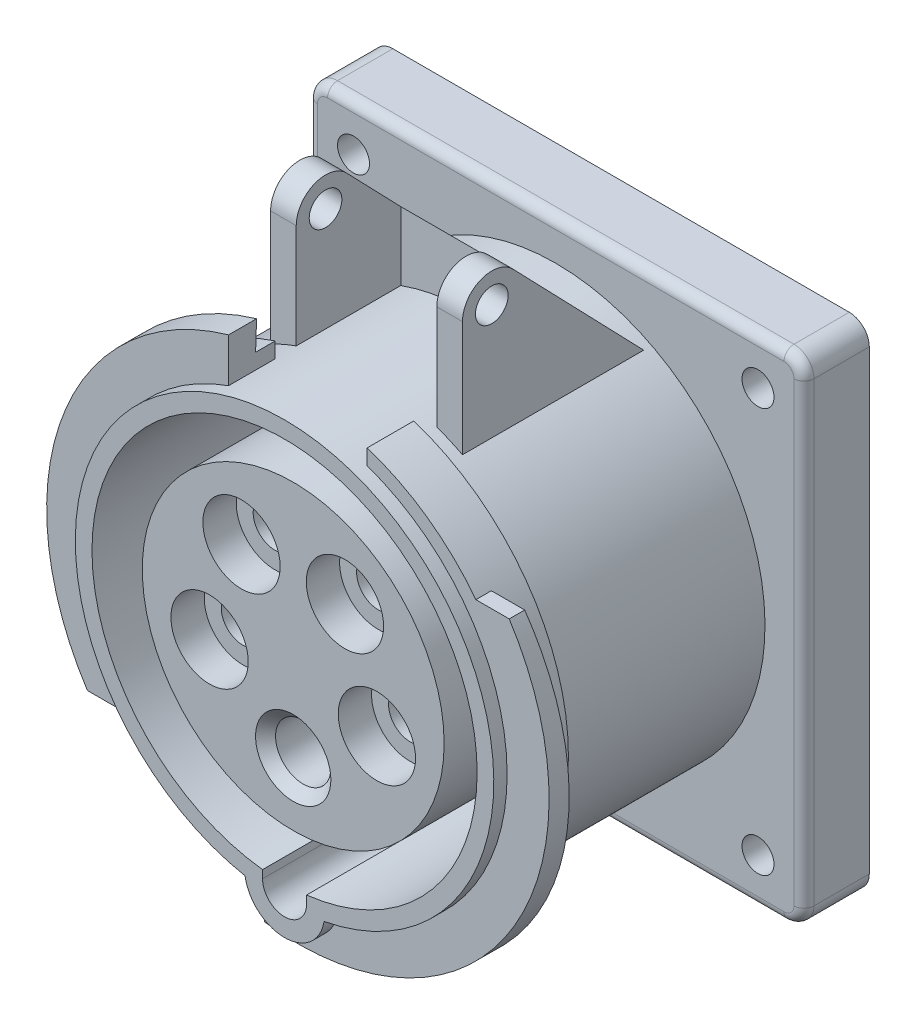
SolidWorks part; units mm, degrees
ref_plane "Спереди" through (0, 0, 0) normal (0, 0, 1) x (1, 0, 0)
ref_plane "Сверху" through (0, 0, 0) normal (0, 1, 0) x (1, 0, 0)
ref_plane "Справа" through (0, 0, 0) normal (1, 0, 0) x (0, 0, -1)
sketch "Эскиз1" plane through (0, 0, 0) normal (0, 0, 1) x (1, 0, 0)
  line L0 (-30.35, 30.35) -> (-30.35, -30.35) construction
  line L1 (-37.25, -37.25) -> (37.25, -37.25)
  line L2 (-37.25, -37.25) -> (-37.25, 37.25)
  line L3 (-37.25, 37.25) -> (37.25, 37.25)
  line L4 (37.25, -37.25) -> (37.25, 37.25)
  line L5 (-37.25, -37.25) -> (37.25, 37.25) construction
  line L6 (-37.25, 37.25) -> (37.25, -37.25) construction
  line L7 (-30.35, -30.35) -> (30.35, -30.35) construction
  line L8 (30.35, -30.35) -> (30.35, 30.35) construction
  line L9 (30.35, 30.35) -> (-30.35, 30.35) construction
  circle A0 centre (-30.35, 30.35) radius 2.4
  circle A1 centre (30.35, 30.35) radius 2.4
  circle A2 centre (30.35, -30.35) radius 2.4
  circle A3 centre (-30.35, -30.35) radius 2.4
  point P0 (0, 0)
  dimension "D3" = 4.8
  dimension "D1" = 74.5
  dimension "D2" = 74.5
  dimension "D4" = 60.7
extrude "Бобышка-Вытянуть1" add sketch "Эскиз1" along normal blind 9.8
sketch "Эскиз2" plane through (0, 0, 9.8) normal (0, 0, 1) x (1, 0, 0)
  circle A0 centre (0, 0) radius 31.4
  dimension "D1" = 62.8
extrude "Бобышка-Вытянуть2" add sketch "Эскиз2" along normal blind 40.7
sketch "Эскиз3" plane through (0, 0, 50.5) normal (0, 0, 1) x (1, 0, 0)
  circle A0 centre (0, 0) radius 28.9
  circle A1 centre (0, 0) radius 22.65
  dimension "D1" = 57.8
  dimension "D2" = 45.3
extrude "Вырез-Вытянуть1" cut sketch "Эскиз3" against normal blind 39
sketch "Эскиз4" plane through (0, 0, 50.5) normal (0, 0, 1) x (1, 0, 0)
  circle A0 centre (0, 0) radius 22.65
  dimension "D1" = 45.3
extrude "Вырез-Вытянуть2" cut sketch "Эскиз4" against normal blind 1.3
sketch "Эскиз5" plane through (0, 0, 49.2) normal (0, 0, 1) x (1, 0, 0)
  line L0 (0, 0) -> (0, -13.2) construction
  line L1 (12.5539, -4.079) -> (-12.5539, -4.079) construction
  line L2 (-7.7588, 10.679) -> (7.7588, 10.679) construction
  circle A0 centre (0, -13.2) radius 4.15
  circle A8 centre (-7.7588, 10.679) radius 5.8
  circle A9 centre (7.7588, 10.679) radius 5.8
  circle A10 centre (-12.5539, -4.079) radius 5.8
  circle A11 centre (12.5539, -4.079) radius 5.8
  point P15 (0, 0)
  dimension "D1" = 8.3
  dimension "D4" = 11.6
  dimension "D2" = 15.5175
  dimension "D3" = 13.2
  dimension "D5" = 14.758
  dimension "D7" = 7.7588
  dimension "D8" = 10.679
  dimension "D9" = 25.1079
  dimension "D10" = 12.5539
extrude "Вырез-Вытянуть3" cut sketch "Эскиз5" against normal blind 5
sketch "Эскиз6" plane through (0, 0, 44.2) normal (0, 0, 1) x (1, 0, 0)
  circle A0 centre (-7.7588, 10.679) radius 3.25
  circle A1 centre (7.7588, 10.679) radius 3.25
  circle A2 centre (-12.5539, -4.079) radius 3.25
  circle A3 centre (12.5539, -4.079) radius 3.25
  circle A4 centre (0, -13.2) radius 4.15
  dimension "D1" = 6.5
  dimension "D2" = 8.3
extrude "Вырез-Вытянуть4" cut sketch "Эскиз6" against normal blind 20
chamfer "Фаска1" distance 1.5 angle 45 1 edges at (4.15, -13.2, 49.2)
sketch "Эскиз7" plane through (0, 0, 9.8) normal (0, 0, 1) x (1, 0, 0)
  arc A0 (-5.9266, -30.8356) -> (5.9266, -30.8356) centre (0, -29.9) ccw
  circle A3 centre (0, 0) radius 31.4 construction
  circle A4 centre (0, 0) radius 31.4 construction
  arc A5 (-5.9266, -30.8356) -> (5.9266, -30.8356) centre (0, 0) ccw
  point P1 (0, 0)
  point P2 (0, -31.4)
  point P3 (0, 0)
  point P4 (0, -35.9)
  dimension "D1" = 12
  dimension "D2" = 4.5
  dimension "D3" = 11.8532
extrude "Бобышка-Вытянуть3" add sketch "Эскиз7" along normal up to surface (40.7 mm away)
sketch "Эскиз8" plane through (0, 0, 50.5) normal (0, 0, 1) x (1, 0, 0)
  line L0 (-3.3, -29.9) -> (-3.3, -28.711)
  line L1 (3.3, -29.9) -> (3.3, -28.711)
  circle A1 centre (0, 0) radius 28.9 construction
  arc A2 (-3.2596, -30.4146) -> (3.2596, -30.4146) centre (0, -29.9) ccw
  arc A3 (-3.3, -29.9) -> (3.3, -29.9) centre (0, -29.9) ccw
  arc A4 (-3.3, -28.711) -> (3.3, -28.711) centre (0, 0) ccw
  dimension "D1" = 2.7
extrude "Вырез-Вытянуть5" cut sketch "Эскиз8" against normal up to surface (39 mm away)
ref_plane "Плоскость1" through (0, 0, 48.5) normal (0, 0, 1) x (1, 0, 0)
sketch "Эскиз9" plane through (0, 0, 48.5) normal (0, 0, 1) x (1, 0, 0)
  circle A0 centre (0, 0) radius 37.7
  arc A1 (-5.9266, -30.8356) -> (5.9266, -30.8356) centre (0, -29.9) ccw construction
  arc A2 (5.9266, -30.8356) -> (-5.9266, -30.8356) centre (0, 0) ccw construction
  arc A3 (-5.9266, -30.8356) -> (5.9266, -30.8356) centre (0, -29.9) ccw
  arc A4 (5.9266, -30.8356) -> (-5.9266, -30.8356) centre (0, 0) ccw
  dimension "D1" = 75.4
extrude "Бобышка-Вытянуть4" add sketch "Эскиз9" against normal blind 4.3
sketch "Эскиз10" plane through (0, 0, 44.2) normal (0, 0, -1) x (-1, 0, 0)
  line L0 (-3.3, -29.9) -> (-3.3, -28.711) construction
  line L1 (3.3, -28.711) -> (3.3, -29.9) construction
  line L2 (-3.3, -29.9) -> (-3.3, -28.711)
  line L3 (3.3, -28.711) -> (3.3, -29.9)
  circle A0 centre (0, 0) radius 33.6
  arc A1 (3.3, -28.711) -> (-3.3, -28.711) centre (0, 0) ccw
  arc A2 (-3.3, -29.9) -> (3.3, -29.9) centre (0, -29.9) ccw construction
  arc A3 (-3.3, -29.9) -> (3.3, -29.9) centre (0, -29.9) ccw
  dimension "D1" = 67.2
extrude "Бобышка-Вытянуть5" add sketch "Эскиз10" along normal blind 2.7
sketch "Эскиз11" plane through (0, 0, 48.5) normal (0, 0, 1) x (1, 0, 0)
  line L0 (-10.4, 36.2371) -> (-10.4, 29.6277)
  line L1 (-4.9932, -33.2269) -> (-4.9932, -37.3679)
  line L2 (-10.4, 39.443) -> (10.4, 39.443) construction
  line L3 (26.7136, 20.3799) -> (31.7167, 20.3799)
  line L4 (10.4, 31.95) -> (10.4, 29.6277)
  line L5 (-26.5589, -20.5811) -> (-31.5865, -20.5811)
  arc A0 (5.9266, -30.8356) -> (-5.9266, -30.8356) centre (0, 0) ccw construction
  arc A1 (5.9266, -30.8356) -> (-5.9266, -30.8356) centre (0, 0) ccw construction
  circle A2 centre (0, 0) radius 37.7 construction
  arc A4 (10.4, 29.6277) -> (-10.4, 29.6277) centre (0, 0) ccw
  arc A5 (4.9932, -33.2269) -> (-4.9932, -33.2269) centre (0, 0) ccw construction
  arc A6 (26.7136, 20.3799) -> (10.4, 31.95) centre (0, 0) ccw
  arc A7 (-26.5589, -20.5811) -> (-4.9932, -33.2269) centre (0, 0) ccw
  arc A8 (-31.5865, -20.5811) -> (-4.9932, -37.3679) centre (0, 0) ccw
  arc A9 (31.7167, 20.3799) -> (-10.4, 36.2371) centre (0, 0) ccw
  point P10 (0, 39.443)
  dimension "D1" = 20.8
  dimension "D2" = 20
  dimension "D3" = 10.4
  dimension "D4" = 25
extrude "Вырез-Вытянуть6" cut sketch "Эскиз11" against normal up to next
sketch "Эскиз12" plane through (0, 0, 44.2) normal (0, 0, -1) x (-1, 0, 0)
  line L0 (0, -37.7) -> (0, -35.9)
  line L1 (4.9932, -33.2269) -> (4.9932, -37.3679) construction
  line L2 (4.9932, -33.2269) -> (4.9932, -37.3679)
  arc A0 (-31.7167, 20.3799) -> (4.9932, -37.3679) centre (0, 0) ccw construction
  arc A1 (-4.9932, -33.2269) -> (4.9932, -33.2269) centre (0, -29.9) ccw construction
  arc A2 (0, -37.7) -> (4.9932, -37.3679) centre (0, 0) ccw
  arc A3 (0, -35.9) -> (4.9932, -33.2269) centre (0, -29.9) ccw
extrude "Вырез-Вытянуть7" cut sketch "Эскиз12" against normal blind 2.3
sketch "Эскиз13" plane through (0, 0, 44.2) normal (0, 0, -1) x (-1, 0, 0)
  line L0 (0, -37.7) -> (0, -35.9)
  line L1 (-2, -37.6469) -> (-2, -35.5569)
  arc A0 (-4.9932, -33.2269) -> (0, -35.9) centre (0, -29.9) ccw construction
  arc A1 (-2, -35.5569) -> (0, -35.9) centre (0, -29.9) ccw
  arc A2 (-31.7167, 20.3799) -> (0, -37.7) centre (0, 0) ccw construction
  arc A3 (-2, -37.6469) -> (0, -37.7) centre (0, 0) ccw
  dimension "D1" = 2
extrude "Бобышка-Вытянуть6" add sketch "Эскиз13" along normal blind 2.5
sketch "Эскиз14" plane through (0, 0, 0) normal (0, 0, -1) x (-1, 0, 0)
  circle A0 centre (0, 0) radius 25.95
  dimension "D1" = 51.9
extrude "Вырез-Вытянуть8" cut sketch "Эскиз14" against normal blind 9.3
sketch "Эскиз15" plane through (0, 0, 9.3) normal (0, 0, -1) x (-1, 0, 0)
  circle A0 centre (0, 0) radius 23.65
  dimension "D1" = 47.3
extrude "Бобышка-Вытянуть7" add sketch "Эскиз15" along normal blind 19.2
fillet "Скругление1" radius 3 4 edges at (37.25, -37.25, 4.9) (-37.25, -37.25, 4.9) (37.25, 37.25, 4.9) (-37.25, 37.25, 4.9)
fillet "Скругление2" radius 1.5 8 edges at (-36.3713, 36.3713, 9.8) (0, 37.25, 9.8) (36.3713, 36.3713, 9.8) (37.25, 0, 9.8) (36.3713, -36.3713, 9.8) (0, -37.25, 9.8) (-36.3713, -36.3713, 9.8) (-37.25, 0, 9.8)
ref_plane "Плоскость2" through (0, 0, 0) normal (-1, 0, 0) x (0, 0, 1)
sketch "Эскиз16" plane through (0, 0, 0) normal (-1, 0, 0) x (0, 0, 1)
  line L0 (2.8964, 49.6) -> (40.8362, 49.6) construction
  line L1 (50.5, 31.4) -> (9.8, 31.4) construction
  line L2 (38.2, 27.9) -> (38.2, 45.2)
  line L3 (41.5, 31.95) -> (41.5, -33.2269) construction
  line L4 (11, 27.9) -> (30.6331, 48.2546)
  line L5 (11, 27.9) -> (38.2, 27.9)
  line L6 (9.8, -30.8356) -> (9.8, 31.4) construction
  arc A0 (38.2, 45.2) -> (30.6331, 48.2546) centre (33.8, 45.2) ccw
  circle A1 centre (33.8, 45.2) radius 2.45
  dimension "D3" = 8.8
  dimension "D6" = 4.9
  dimension "D1" = 18.2
  dimension "D2" = 3.3
  dimension "D4" = 21.7
  dimension "D5" = 1.2
extrude "Бобышка-Вытянуть8" add sketch "Эскиз16" along normal mid plane 28.8
ref_plane "Плоскость3" through (0, 49.6, 0) normal (0, 1, 0) x (1, 0, 0)
sketch "Эскиз19" plane through (0, 49.6, 0) normal (0, 1, 0) x (1, 0, 0)
  line L0 (-10.55, -38.2) -> (10.55, -38.2)
  line L1 (-14.4, -38.2) -> (14.4, -38.2) construction
  line L2 (10.55, -38.2) -> (10.55, -22.5)
  line L3 (10.55, -22.5) -> (-10.55, -22.5)
  line L4 (-10.55, -22.5) -> (-10.55, -38.2)
  line L5 (0, 4.565) -> (0, -4.565) construction
  point P4 (0, -22.5)
  dimension "D1" = 21.1
  dimension "D2" = 15.7
extrude "Вырез-Вытянуть9" cut sketch "Эскиз19" against normal up to surface (20.0254 mm away)
sketch "Эскиз20" plane through (0, 0, -9.9) normal (0, 0, -1) x (-1, 0, 0)
  line L0 (-5.4, -7.1626) -> (-5.4, 0.2)
  line L1 (-5.4, 0.2) -> (5.4, 0.2)
  line L2 (5.4, 0.2) -> (5.4, -7.1626)
  arc A0 (-5.4, -7.1626) -> (5.4, -7.1626) centre (0, -13.2) ccw
  circle A1 centre (0, -13.2) radius 2.6
  point P5 (0, 0.2)
  dimension "D1" = 16.2
  dimension "D4" = 5.2
  dimension "D2" = 10.8
  dimension "D3" = 13.4
extrude "Бобышка-Вытянуть10" add sketch "Эскиз20" along normal blind 7
ref_plane "Плоскость4" through (0, 23.65, 0) normal (0, 1, 0) x (1, 0, 0)
sketch "Эскиз21" plane through (0, 23.65, 0) normal (0, 1, 0) x (1, 0, 0)
  line L0 (23.65, 9.9) -> (-23.65, 9.9) construction
  line L1 (-3.9, 14.6) -> (3.9, 14.6)
  line L2 (-3.9, 14.6) -> (-3.9, 9.9)
  line L3 (-3.9, 9.9) -> (-2.575, 9.9)
  line L4 (3.9, 14.6) -> (3.9, 9.9)
  line L5 (-5.4, 16.9) -> (5.4, 16.9) construction
  line L6 (5.4, 16.9) -> (5.4, 9.9) construction
  line L9 (-2.575, 9.9) -> (-2.575, 2)
  line L10 (-2.575, 2) -> (2.575, 2)
  line L11 (2.575, 9.9) -> (2.575, 2)
  line L12 (34.25, 0) -> (-34.25, 0) construction
  line L13 (2.575, 9.9) -> (3.9, 9.9)
  point P6 (0, 14.6)
  point P9 (0, 16.9)
  point P19 (0, 2)
  dimension "D1" = 2.3
  dimension "D2" = 1.5
  dimension "D3" = 5.15
  dimension "D4" = 2
extrude "Вырез-Вытянуть10" cut sketch "Эскиз21" against normal blind 28.5
sketch "Эскиз22" plane through (0, 0, -9.9) normal (0, 0, -1) x (-1, 0, 0)
  line L0 (-12.9929, 2.7779) -> (-10.2882, -3.0225)
  line L1 (-17.5245, 0.6648) -> (-14.8197, -5.1356)
  line L2 (-12.9929, 2.7779) -> (-17.5245, 0.6648)
  line L3 (0, 0) -> (0, -13.2) construction
  line L4 (0, -13.2) -> (0, 0) construction
  line L5 (17.5245, 0.6648) -> (14.8197, -5.1356)
  line L6 (12.9929, 2.7779) -> (17.5245, 0.6648)
  line L7 (12.9929, 2.7779) -> (10.2882, -3.0225)
  circle A0 centre (-7.7588, 10.679) radius 2.5
  circle A1 centre (7.7588, 10.679) radius 2.5
  arc A3 (-14.8197, -5.1356) -> (-10.2882, -3.0225) centre (-12.5539, -4.079) ccw
  arc A4 (14.8197, -5.1356) -> (10.2882, -3.0225) centre (12.5539, -4.079) cw
  dimension "D1" = 5
  dimension "D2" = 6.4
  dimension "D3" = 25
extrude "Вырез-Вытянуть11" cut sketch "Эскиз22" against normal blind 3
sketch "Эскиз23" plane through (0, 0, -6.9) normal (0, 0, -1) x (-1, 0, 0)
  circle A0 centre (-7.7588, 10.679) radius 2
  circle A1 centre (7.7588, 10.679) radius 2
  circle A2 centre (-12.5539, -4.079) radius 2
  circle A3 centre (12.5539, -4.079) radius 2
  dimension "D1" = 4
extrude "Вырез-Вытянуть12" cut sketch "Эскиз23" against normal blind 3
sketch "Эскиз24" plane through (0, 0, -9.9) normal (0, 0, -1) x (-1, 0, 0)
  line L0 (0, -13.2) -> (-4.2376, -13.2) construction
  line L1 (0, 0.2) -> (0, -8.4735) construction
  line L2 (5.4, 0.2) -> (-5.4, 0.2) construction
  circle A0 centre (-11.701, -13.95) radius 3.625
  arc A1 (-5.4, -7.1626) -> (5.4, -7.1626) centre (0, -13.2) ccw construction
  circle A2 centre (11.701, -13.95) radius 3.625
  circle A3 centre (0, 18.5613) radius 3.625
  circle A4 centre (0, 0.2) radius 18.3613 construction
  point P17 (0, 18.5613)
  dimension "D1" = 7.25
  dimension "D2" = 1.5
extrude "Вырез-Вытянуть13" cut sketch "Эскиз24" against normal blind 9.5
sketch "Эскиз25" plane through (0, 0, -9.9) normal (0, 0, -1) x (-1, 0, 0)
  text T0 "L3" font "Arial" height 2.5
  text T1 "L2" font "Arial" height 2.5
  text T2 "L1" font "Arial" height 2.5
  text T3 "N" font "Arial" height 2.5
  point P2 (4.5763, 14.2679)
  point P4 (0, 7.5528)
  point P7 (0, 0)
extrude "Бобышка-Вытянуть11" add sketch "Эскиз25" along normal blind 0.1
sketch "Эскиз26" plane through (0, 0, -16.9) normal (0, 0, -1) x (-1, 0, 0)
  line L0 (5.4, 0.2) -> (-5.4, 0.2) construction
  line L1 (-0.15, -2.6) -> (0.15, -2.6)
  line L2 (-0.15, -2.6) -> (-0.15, -5.6)
  line L4 (0.15, -2.6) -> (0.15, -5.6)
  line L5 (0.15, -5.6) -> (3.2, -5.6)
  line L6 (-3.2, -5.6) -> (-0.15, -5.6)
  line L7 (-3.2, -5.6) -> (-3.2, -5.9)
  line L8 (-3.2, -5.9) -> (3.2, -5.9)
  line L9 (3.2, -5.6) -> (3.2, -5.9)
  line L11 (-1.95, -6.7) -> (1.95, -6.7)
  line L12 (-1.95, -6.7) -> (-1.95, -7)
  line L13 (-1.95, -7) -> (1.95, -7)
  line L14 (1.95, -6.7) -> (1.95, -7)
  line L15 (-1.05, -7.8) -> (1.05, -7.8)
  line L16 (-1.05, -7.8) -> (-1.05, -8.1)
  line L17 (-1.05, -8.1) -> (1.05, -8.1)
  line L18 (1.05, -7.8) -> (1.05, -8.1)
  point P4 (0, -2.6)
  point P16 (0, -6.7)
  point P17 (0, -5.9)
  point P18 (0, -7.8)
  point P19 (0, -7)
  dimension "D1" = 0.3
  dimension "D2" = 3
  dimension "D3" = 2.8
  dimension "D4" = 6.4
  dimension "D5" = 0.3
  dimension "D6" = 0.3
  dimension "D7" = 0.8
  dimension "D8" = 3.9
  dimension "D9" = 2.1
  dimension "D10" = 0.3
  dimension "D11" = 0.8
extrude "Бобышка-Вытянуть12" add sketch "Эскиз26" along normal blind 0.1
ref_plane "Плоскость6" through (0, 0.364, 10.9739) normal (0, -0.0332, -0.9995) x (-1, 0, 0)
ref_plane "Плоскость7" through (0, 1.5079, 45.4549) normal (0, 0.0332, 0.9995) x (1, 0, 0)
sketch "Эскиз29" plane through (0, 0, 44.2) normal (0, 0, -1) x (-1, 0, 0)
  line L2 (10.4, 36.2371) -> (10.4, 31.95)
  line L3 (26.5589, -20.5811) -> (31.5865, -20.5811)
  line L4 (10.4, 36.2371) -> (10.4, 31.95)
  line L5 (26.5589, -20.5811) -> (31.5865, -20.5811)
  arc A2 (31.5865, -20.5811) -> (10.4, 36.2371) centre (0, 0) ccw
  arc A3 (26.5589, -20.5811) -> (10.4, 31.95) centre (0, 0) ccw
  arc A4 (31.5865, -20.5811) -> (10.4, 36.2371) centre (0, 0) ccw
  arc A5 (26.5589, -20.5811) -> (10.4, 31.95) centre (0, 0) ccw
  dimension "D1" = 0
extrude "Вырез-Вытянуть15" cut sketch "Эскиз29" against normal up to surface (1.9877 mm away)
ref_plane "Плоскость8" through (0, -0.364, 10.9739) normal (0, -0.0332, 0.9995) x (1, 0, 0)
ref_plane "Плоскость9" through (0, -1.5079, 45.4549) normal (0, -0.0332, 0.9995) x (1, 0, 0)
sketch "Эскиз30" plane through (0, 0, 44.2) normal (0, 0, -1) x (-1, 0, 0)
  line L2 (-2, -37.6469) -> (-2, -35.5569)
  line L3 (-26.7136, 20.3799) -> (-31.7167, 20.3799)
  line L4 (-2, -37.6469) -> (-2, -35.5569)
  line L5 (-26.7136, 20.3799) -> (-31.7167, 20.3799)
  arc A3 (-4.9932, -33.2269) -> (-2, -35.5569) centre (0, -29.9) ccw
  arc A4 (-26.7136, 20.3799) -> (-4.9932, -33.2269) centre (0, 0) ccw
  arc A5 (-31.7167, 20.3799) -> (-2, -37.6469) centre (0, 0) ccw
  arc A6 (-4.9932, -33.2269) -> (-2, -35.5569) centre (0, -29.9) ccw
  arc A7 (-26.7136, 20.3799) -> (-4.9932, -33.2269) centre (0, 0) ccw
  arc A8 (-31.7167, 20.3799) -> (-2, -37.6469) centre (0, 0) ccw
  dimension "D1" = 0
extrude "Вырез-Вытянуть16" cut sketch "Эскиз30" against normal up to surface (1.981 mm away)
